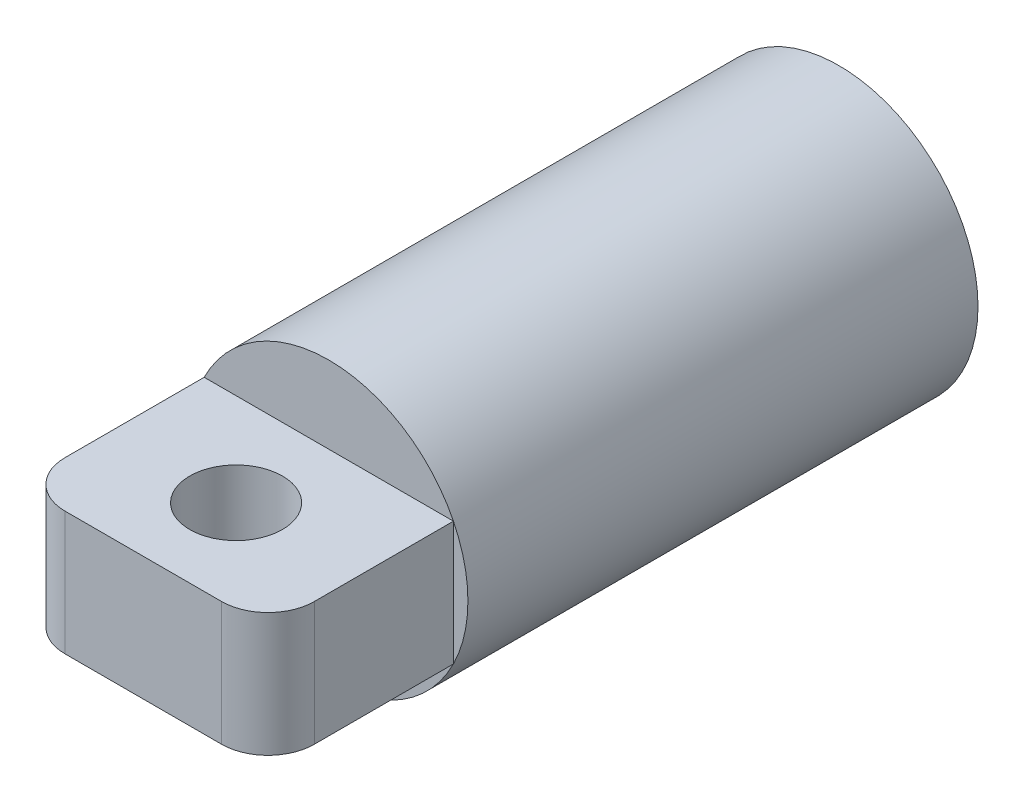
SolidWorks part; units mm, degrees
ref_plane "Front Plane" through (0, 0, 0) normal (0, 0, 1) x (1, 0, 0)
ref_plane "Top Plane" through (0, 0, 0) normal (0, 1, 0) x (1, 0, 0)
ref_plane "Right Plane" through (0, 0, 0) normal (1, 0, 0) x (0, 0, -1)
sketch "Sketch1" plane through (0, 0, 0) normal (0, 0, 1) x (1, 0, 0)
  circle A0 centre (0, 0) radius 9
  dimension "D1" = 18
extrude "Boss-Extrude1" add sketch "Sketch1" along normal blind 45
sketch "Sketch2" plane through (0, 0, 45) normal (0, 0, 1) x (1, 0, 0)
  line L1 (-8.0623, -4) -> (8.0623, -4)
  line L2 (-8.0623, -4) -> (-8.0623, 4)
  line L3 (-8.0623, 4) -> (8.0623, 4)
  line L4 (8.0623, -4) -> (8.0623, 4)
  line L5 (-8.0623, -4) -> (8.0623, 4) construction
  line L6 (-8.0623, 4) -> (8.0623, -4) construction
  circle A4 centre (0, 0) radius 9 construction
  point P0 (0, 0)
  dimension "D1" = 8
extrude "Cut-Extrude1" cut sketch "Sketch2" against normal blind 12 flip side to cut
fillet "Fillet2" radius 3 2 edges at (8.0623, 0, 45) (-8.0623, 0, 45)
sketch "Sketch4" plane through (0, -4, 0) normal (0, -1, 0) x (1, 0, 0)
  line L0 (-8.0623, 42) -> (0, 42) construction
  circle A0 centre (0, 39) radius 3
  dimension "D1" = 6
extrude "Cut-Extrude2" cut sketch "Sketch4" against normal blind 8
